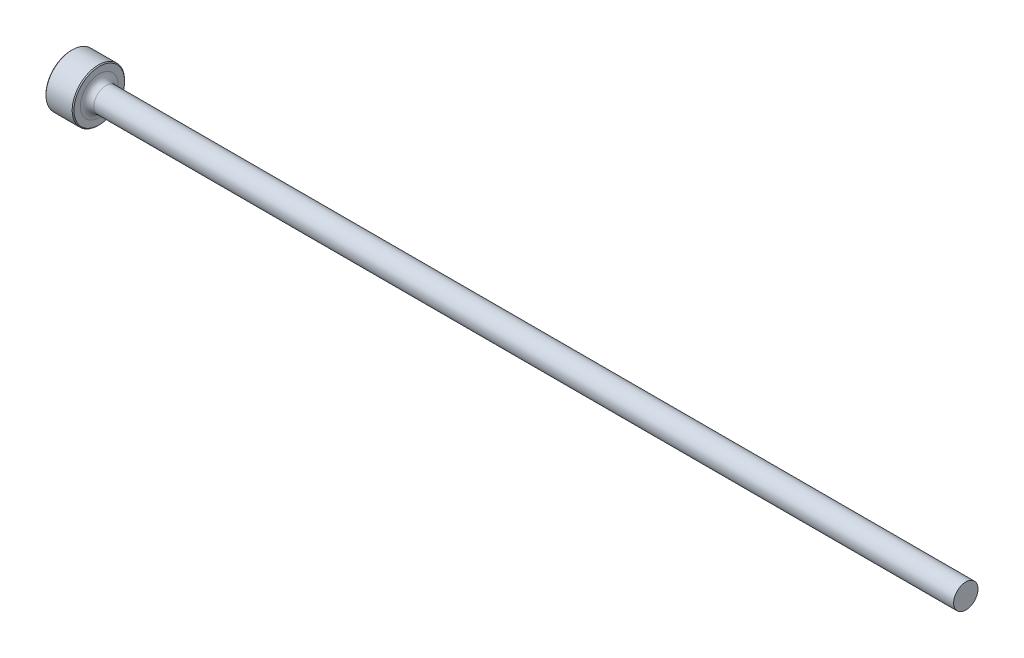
SolidWorks part; units mm, degrees
ref_plane "Front Plane" through (0, 0, 0) normal (0, 0, 1) x (1, 0, 0)
ref_plane "Top Plane" through (0, 0, 0) normal (0, 1, 0) x (1, 0, 0)
ref_plane "Right Plane" through (0, 0, 0) normal (1, 0, 0) x (0, 0, -1)
sketch "Sketch1" plane through (0, 0, 0) normal (0, 0, 1) x (1, 0, 0)
  line L0 (0, 0) -> (0, 2.9766)
  line L1 (0, 2.9766) -> (3.175, 2.9766)
  line L2 (3.175, 2.9766) -> (3.175, 2.1473)
  line L3 (3.937, 1.3853) -> (101.6, 1.3853)
  line L4 (101.6, 1.3853) -> (101.6, 0)
  line L5 (101.6, 0) -> (0, 0)
  line L6 (101.6, 0) -> (101.6, -1.3853) construction
  line L7 (101.6, -1.3853) -> (3.175, -1.3853) construction
  line L8 (0, 0) -> (0, -2.9766) construction
  line L9 (0, -2.9766) -> (3.175, -2.9766) construction
  line L10 (3.175, -2.9766) -> (3.175, -1.3853) construction
  arc A0 (3.175, 2.1473) -> (3.937, 1.3853) centre (3.937, 2.1473) ccw
  dimension "D4" = 0.762
  dimension "L" = 101.6
  dimension "D" = 2.7705
  dimension "H" = 5.9531
  dimension "T" = 3.175
revolve "Revolve1" add sketch "Sketch1" angle 360 about L5
chamfer "Chamfer1" distance 0.1016 angle 45 2 edges at (0, 2.9766, 0) (3.175, 2.9766, 0)
